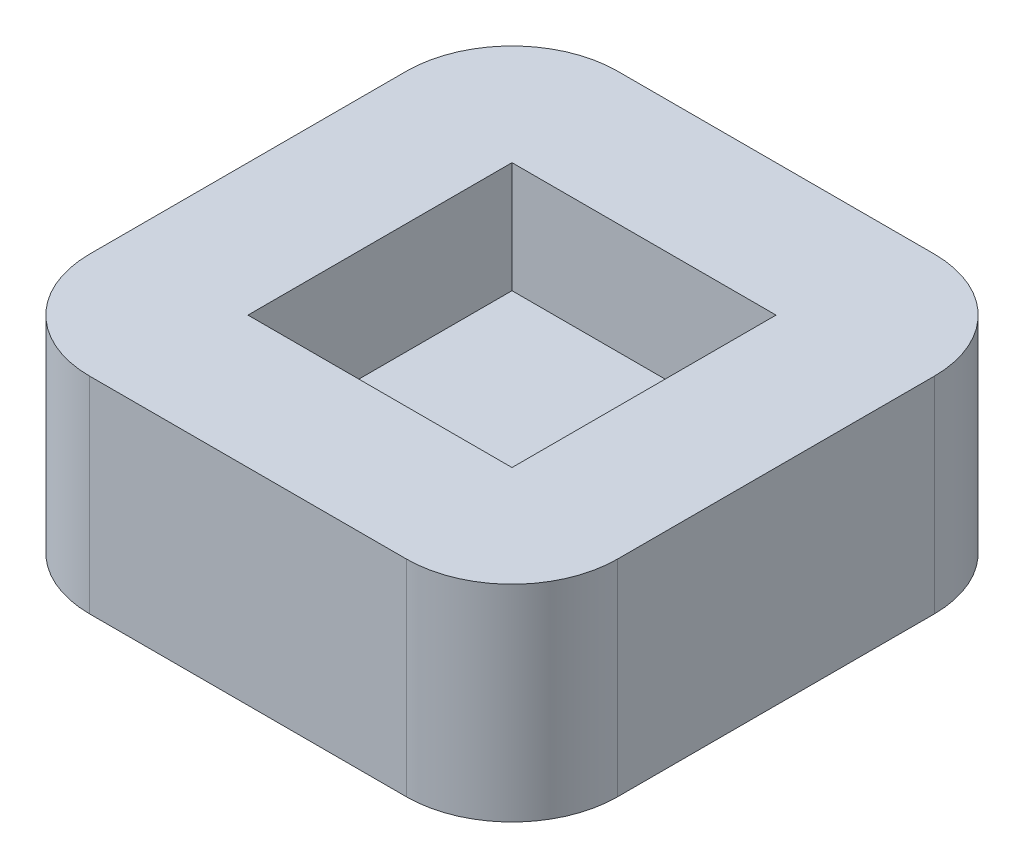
SolidWorks part; units mm, degrees
ref_plane "Front Plane" through (0, 0, 0) normal (0, 0, 1) x (1, 0, 0)
ref_plane "Top Plane" through (0, 0, 0) normal (0, 1, 0) x (1, 0, 0)
ref_plane "Right Plane" through (0, 0, 0) normal (1, 0, 0) x (0, 0, -1)
sketch "Sketch1" plane through (0, 0, 0) normal (0, 1, 0) x (1, 0, 0)
  line L0 (50, -50) -> (-50, 50) construction
  line L1 (-30, 50) -> (30, 50)
  line L2 (-50, 30) -> (-50, -30)
  line L3 (-30, -50) -> (30, -50)
  line L4 (50, 30) -> (50, -30)
  arc A0 (-30, 50) -> (-50, 30) centre (-30, 30) ccw
  arc A1 (30, 50) -> (50, 30) centre (30, 30) cw
  arc A2 (30, -50) -> (50, -30) centre (30, -30) ccw
  arc A3 (-50, -30) -> (-30, -50) centre (-30, -30) ccw
  dimension "D1" = 20
  dimension "D2" = 100
extrude "Extrude1" add sketch "Sketch1" along normal blind 39
sketch "Sketch2" plane through (0, 39, 0) normal (0, 1, 0) x (-1, 0, 0)
  line L0 (-25, 25) -> (25, -25) construction
  line L1 (25, -25) -> (-25, -25)
  line L2 (25, -25) -> (25, 25)
  line L3 (25, 25) -> (-25, 25)
  line L4 (-25, -25) -> (-25, 25)
  dimension "D1" = 50
extrude "Cut-Extrude1" cut sketch "Sketch2" against normal blind 21
